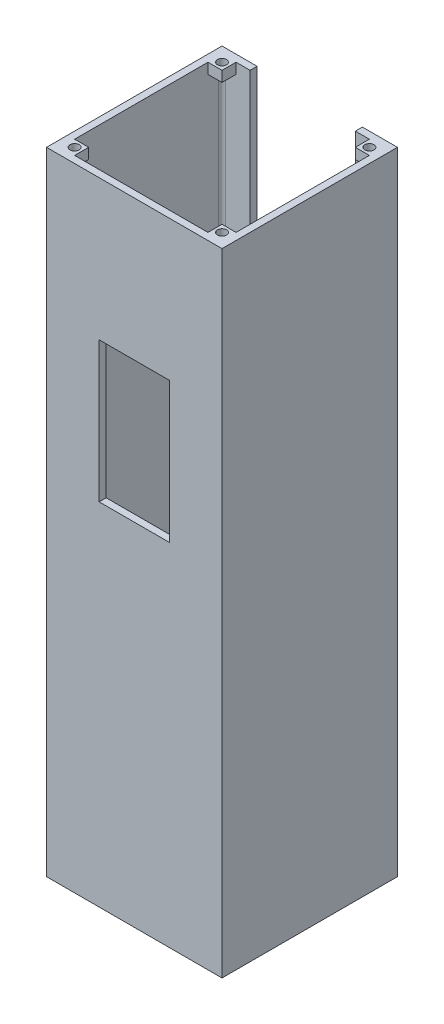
SolidWorks part; units mm, degrees
ref_plane "Front Plane" through (0, 0, 0) normal (0, 0, 1) x (1, 0, 0)
ref_plane "Top Plane" through (0, 0, 0) normal (0, 1, 0) x (1, 0, 0)
ref_plane "Right Plane" through (0, 0, 0) normal (1, 0, 0) x (0, 0, -1)
sketch "Sketch2" plane through (0, 0, 0) normal (0, 1, 0) x (1, 0, 0)
  line L1 (0, 0) -> (63.5, 0)
  line L2 (0, 0) -> (0, 63.5)
  line L3 (0, 63.5) -> (63.5, 63.5)
  line L4 (63.5, 0) -> (63.5, 63.5)
extrude "Boss-Extrude2" add sketch "Sketch2" against normal blind 304.8
sketch "Sketch3" plane through (0, 0, 0) normal (0, 1, 0) x (1, 0, 0)
  line L0 (0, 0) -> (0, 2.54)
  line L1 (0, 63.5) -> (0, 0) construction
  line L2 (0, 2.54) -> (2.54, 2.54)
  line L3 (63.5, 63.5) -> (63.5, 60.96)
  line L4 (63.5, 60.96) -> (60.96, 60.96)
  line L6 (2.54, 2.54) -> (60.96, 2.54)
  line L7 (2.54, 2.54) -> (2.54, 60.96)
  line L8 (2.54, 60.96) -> (60.96, 60.96)
  line L9 (60.96, 2.54) -> (60.96, 60.96)
extrude "Cut-Extrude2" cut sketch "Sketch3" against normal blind 302.26 contours L6 L9 L8 L7
sketch3d "3DSketch1"
  line L0 (0, 0, -63.5) -> (0, 0, 0) construction
  point P0 (0, 0, -61.7439)
sketch "Sketch5" plane through (0, 0, 0) normal (0, 1, 0) x (1, 0, 0)
  line L1 (0, 0) -> (63.5, 0)
  line L2 (0, 0) -> (0, 63.5)
  line L3 (0, 63.5) -> (63.5, 63.5)
  line L4 (63.5, 0) -> (63.5, 63.5)
extrude "Cut-Extrude3" cut sketch "Sketch5" against normal blind 2.54
sketch "Sketch6" plane through (0, 0, 0) normal (0, 0, 1) x (1, 0, 0)
  line L0 (0, -304.8) -> (63.5, -304.8)
  line L1 (63.5, -304.8) -> (31.75, -304.8)
  line L2 (31.75, -304.8) -> (31.75, -152.4)
  circle A0 centre (31.75, -152.4) radius 12.7
extrude "Cut-Extrude4" cut sketch "Sketch6" against normal blind 12.7
sketch "Sketch11" plane through (0, 0, 0) normal (0, 0, 1) x (1, 0, 0)
  line L0 (31.75, -152.4) -> (31.75, -158.75)
  line L1 (44.45, -152.4) -> (44.45, -173.6752)
  line L2 (19.05, -152.4) -> (19.05, -158.75)
  circle A0 centre (31.75, -152.4) radius 12.7 construction
  circle A1 centre (31.75, -158.75) radius 12.7
extrude "Cut-Extrude7" cut sketch "Sketch11" against normal blind 2.54 contours A1 L2 M3 | A1 M3 | A1 L1 M3
sketch "Sketch12" plane through (0, 0, 0) normal (0, 0, 1) x (1, 0, 0)
  line L0 (31.75, -152.4) -> (31.75, -146.05)
  line L1 (19.05, -146.05) -> (19.05, -155.575)
  line L2 (19.05, -152.4) -> (19.05, -158.75) construction
  line L3 (44.45, -146.05) -> (44.45, -158.75)
  circle A0 centre (31.75, -146.05) radius 12.7
extrude "Cut-Extrude8" cut sketch "Sketch12" against normal blind 2.54 contours A0 M3 | A0 L1 M3 | A0 L3 M3
sketch "Sketch14" plane through (0, 0, -63.5) normal (0, 0, -1) x (-1, 0, 0)
  line L0 (-63.5, -304.8) -> (-50.8, -304.8)
  line L1 (-63.5, -304.8) -> (0, -304.8) construction
  line L2 (-50.8, -304.8) -> (-50.8, -292.1)
  line L3 (0, -2.54) -> (0, -15.24)
  line L4 (0, -304.8) -> (0, -2.54) construction
  line L5 (0, -15.24) -> (-12.7, -15.24)
  line L7 (-12.7, -15.24) -> (-50.8, -15.24)
  line L8 (-12.7, -15.24) -> (-12.7, -292.1)
  line L9 (-12.7, -292.1) -> (-50.8, -292.1)
  line L10 (-50.8, -15.24) -> (-50.8, -292.1)
extrude "Cut-Extrude9" cut sketch "Sketch14" against normal blind 2.54 contours L7 L10 L9 L8
fillet "Fillet1" radius 1.27 4 edges at (2.54, -152.4, -2.54) (2.54, -152.4, -60.96) (60.96, -152.4, -60.96) (60.96, -152.4, -2.54)
ref_plane "Plane1" through (63.5, -2.54, 0) normal (0, 1, 0) x (1, 0, 0)
sketch "Sketch15" plane through (63.5, -2.54, 0) normal (0, 1, 0) x (1, 0, 0)
  line L1 (-63.5, 0) -> (0, 0)
  line L2 (-63.5, 0) -> (-63.5, 63.5)
  line L3 (-63.5, 63.5) -> (0, 63.5)
  line L4 (0, 0) -> (0, 63.5)
extrude "Cut-Extrude10" cut sketch "Sketch15" against normal blind 73.66
sketch "Sketch16" plane through (0, -76.2, 0) normal (0, 1, 0) x (1, 0, 0)
  line L0 (3.81, 60.96) -> (2.54, 60.96)
  line L1 (2.54, 60.96) -> (2.54, 59.69)
  line L2 (59.69, 60.96) -> (60.96, 60.96)
  line L3 (2.54, 60.96) -> (7.62, 60.96)
  line L4 (2.54, 60.96) -> (2.54, 55.88)
  line L5 (2.54, 55.88) -> (7.62, 55.88)
  line L6 (7.62, 60.96) -> (7.62, 55.88)
  line L7 (60.96, 60.96) -> (60.96, 59.69)
  line L8 (59.69, 2.54) -> (60.96, 2.54)
  line L9 (60.96, 60.96) -> (55.88, 60.96)
  line L10 (60.96, 60.96) -> (60.96, 55.88)
  line L11 (60.96, 55.88) -> (55.88, 55.88)
  line L12 (55.88, 60.96) -> (55.88, 55.88)
  line L13 (60.96, 2.54) -> (60.96, 3.81)
  line L14 (3.81, 2.54) -> (2.54, 2.54)
  line L15 (60.96, 2.54) -> (55.88, 2.54)
  line L16 (60.96, 2.54) -> (60.96, 7.62)
  line L17 (60.96, 7.62) -> (55.88, 7.62)
  line L18 (55.88, 2.54) -> (55.88, 7.62)
  line L19 (2.54, 2.54) -> (2.54, 3.81)
  line L21 (2.54, 2.54) -> (7.62, 2.54)
  line L22 (2.54, 2.54) -> (2.54, 7.62)
  line L23 (2.54, 7.62) -> (7.62, 7.62)
  line L24 (7.62, 2.54) -> (7.62, 7.62)
  circle A0 centre (5.08, 5.08) radius 1.651
  circle A1 centre (58.42, 5.08) radius 1.651
  circle A2 centre (58.42, 58.42) radius 1.651
  circle A3 centre (5.08, 58.42) radius 1.651
extrude "Boss-Extrude3" add sketch "Sketch16" against normal blind 3.81 contours L6 L5 A3 M37 M36 M35 | L12 L11 A2 M29 M31 M30 | L24 L23 A0 M33 M35 M34 | L15 L18 L17 L16
sketch "Sketch17" plane through (0, -76.2, 0) normal (0, 1, 0) x (1, 0, 0)
  line L0 (55.88, 2.54) -> (60.96, 7.62)
  line L1 (60.96, 3.81) -> (60.96, 59.69) construction
  line L2 (60.96, 7.62) -> (60.96, 55.88) construction
  line L3 (60.96, 7.62) -> (55.88, 7.62)
  line L4 (55.88, 7.62) -> (60.96, 2.54)
  circle A0 centre (58.42, 5.08) radius 1.651
extrude "Cut-Extrude11" cut sketch "Sketch17" against normal blind 3.81 contours L0 A0 L4 | L4 A0 L0 | L0 A0 L4 | L4 A0 L0
sketch "Sketch18" plane through (0, 0, 0) normal (0, 0, 1) x (1, 0, 0)
  line L0 (44.45, -152.4) -> (19.05, -152.4)
  line L1 (44.45, -146.05) -> (44.45, -158.75) construction
  line L2 (19.05, -146.05) -> (19.05, -158.75) construction
  line L3 (31.75, -133.35) -> (31.75, -171.45)
  line L4 (31.75, -152.4) -> (31.75, -127)
  line L5 (31.75, -127) -> (44.45, -127)
  line L7 (44.45, -127) -> (19.05, -127)
  line L8 (44.45, -127) -> (44.45, -177.8)
  line L9 (44.45, -177.8) -> (19.05, -177.8)
  line L10 (19.05, -127) -> (19.05, -177.8)
  arc A0 (44.45, -146.05) -> (19.05, -146.05) centre (31.75, -146.05) ccw construction
  arc A1 (19.05, -158.75) -> (44.45, -158.75) centre (31.75, -158.75) ccw construction
extrude "Cut-Extrude12" cut sketch "Sketch18" against normal blind 5.08 contours L8 L5 L4 M10 | L7 L10 L4 M10 | L10 L9 L8 M12
